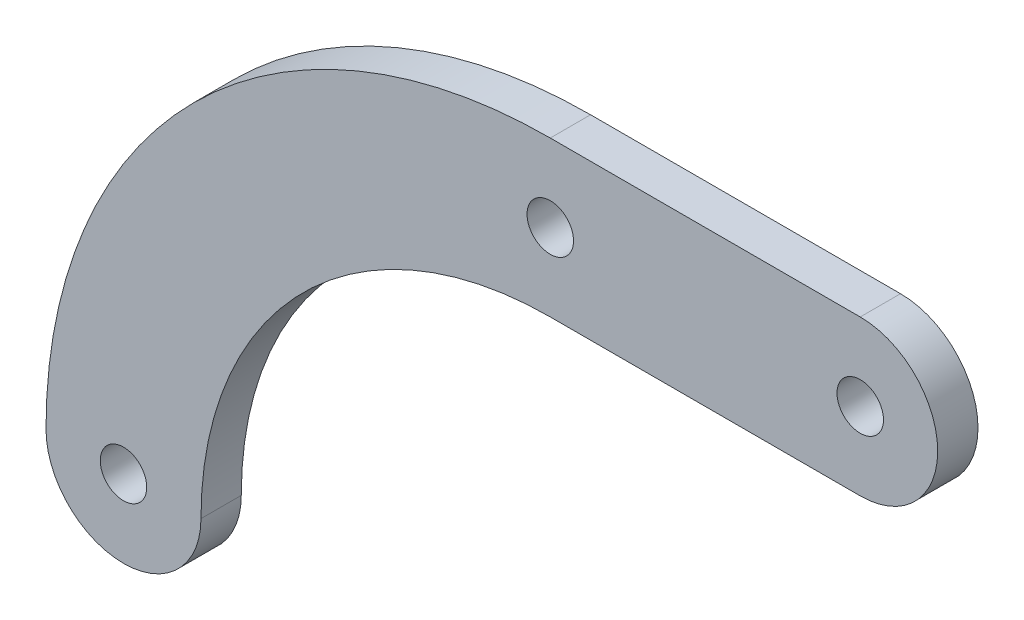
SolidWorks part; units mm, degrees
ref_plane "Front Plane" through (0, 0, 0) normal (0, 0, 1) x (1, 0, 0)
ref_plane "Top Plane" through (0, 0, 0) normal (0, 1, 0) x (1, 0, 0)
ref_plane "Right Plane" through (0, 0, 0) normal (1, 0, 0) x (0, 0, -1)
sketch "Sketch1" plane through (0, 0, 0) normal (0, 0, 1) x (1, 0, 0)
  line L0 (-22.54, 0) -> (-27.54, 0) construction
  line L1 (-27.54, 0) -> (-32.54, 0) construction
  line L2 (0, 22.54) -> (20, 22.54)
  line L3 (0, 32.54) -> (20, 32.54)
  arc A0 (0, 32.54) -> (-32.54, 0) centre (0, 0) ccw
  arc A1 (0, 22.54) -> (-22.54, 0) centre (0, 0) ccw
  circle A2 centre (0, 0) radius 27.54 construction
  arc A3 (20, 22.54) -> (20, 32.54) centre (20, 27.54) ccw
  circle A4 centre (-27.54, 0) radius 1.5
  arc A5 (-32.54, 0) -> (-22.54, 0) centre (-27.54, 0) ccw
  circle A6 centre (0, 27.54) radius 1.5
  circle A7 centre (20, 27.54) radius 1.5
  dimension "D3" = 3
  dimension "D4" = 3
  dimension "D5" = 3
  dimension "D1" = 27.54
  dimension "D2" = 5
  dimension "D6" = 20
extrude "Boss-Extrude1" add sketch "Sketch1" along normal blind 2.6
